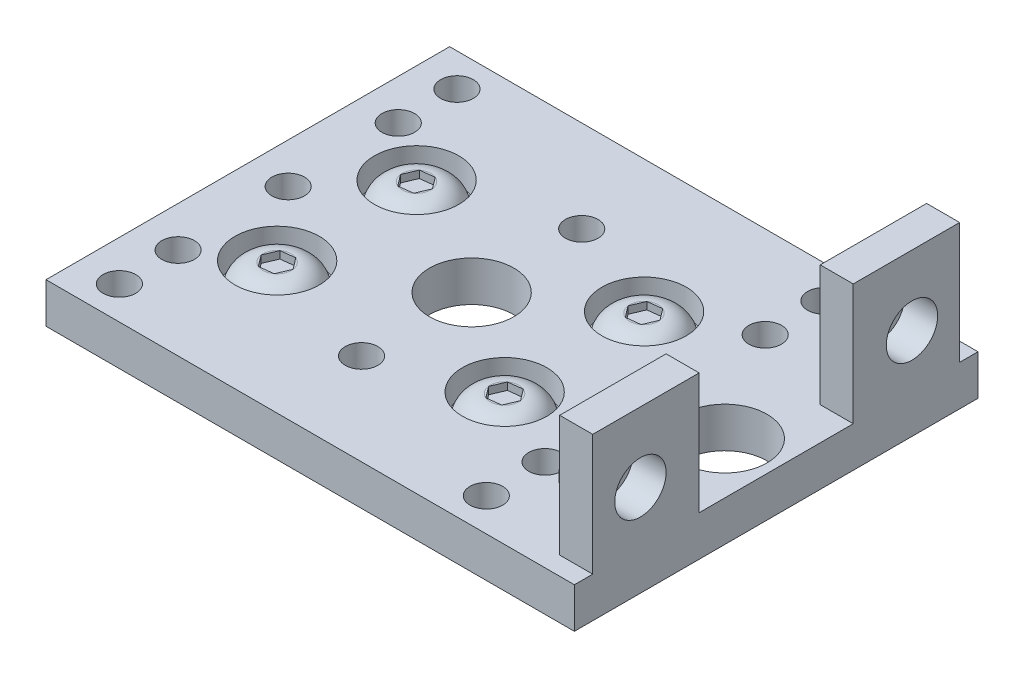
SolidWorks part; units mm, degrees
ref_plane "Front Plane" through (0, 0, 0) normal (0, 0, 1) x (1, 0, 0)
ref_plane "Top Plane" through (0, 0, 0) normal (0, 1, 0) x (1, 0, 0)
ref_plane "Right Plane" through (0, 0, 0) normal (1, 0, 0) x (0, 0, -1)
sketch "Sketch3" plane through (0, 0, 0) normal (0, 1, 0) x (1, 0, 0)
  line L1 (0, 27.94) -> (36.576, 27.94)
  line L2 (0, 27.94) -> (0, 0)
  line L3 (0, 0) -> (36.576, 0)
  line L4 (36.576, 27.94) -> (36.576, 0)
  dimension "D1" = 36.576
  dimension "D2" = 27.94
extrude "Base" add sketch "Sketch3" along normal blind 2.794
sketch "Sketch5" plane through (0, 0, 0) normal (0, 1, 0) x (1, 0, 0)
  line L0 (36.576, 26.67) -> (34.29, 26.67)
  line L1 (36.576, 26.67) -> (36.576, 19.304)
  line L2 (36.576, 19.304) -> (34.29, 19.304)
  line L3 (34.29, 26.67) -> (34.29, 19.304)
  line L4 (36.576, 8.636) -> (34.29, 8.636)
  line L5 (36.576, 8.636) -> (36.576, 1.27)
  line L6 (36.576, 1.27) -> (34.29, 1.27)
  line L7 (34.29, 8.636) -> (34.29, 1.27)
  line L8 (36.576, 0) -> (36.576, 27.94) construction
  line L9 (0, 0) -> (36.576, 0) construction
  line L10 (0, 27.94) -> (0, 0) construction
  dimension "D1" = 1.27
  dimension "D2" = 8.636
  dimension "D3" = 19.304
  dimension "D4" = 26.67
  dimension "D5" = 34.29
extrude "Tabs" add sketch "Sketch5" along normal blind 11.176
sketch "Sketch6" plane through (36.576, 0, 0) normal (1, 0, 0) x (0, 0, -1)
  circle A0 centre (4.572, 6.35) radius 1.778
  circle A1 centre (23.368, 6.35) radius 1.778
  dimension "D4" = 3.556
  dimension "D1" = 4.572
  dimension "D2" = 23.368
  dimension "D3" = 6.35
extrude "Tab Holes" cut sketch "Sketch6" against normal through all
sketch "Hole Locations" plane through (0, 2.794, 0) normal (0, 1, 0) x (1, 0, 0)
  line L0 (0, 27.94) -> (0, 0) construction
  line L1 (2.794, 25.654) -> (28.194, 25.654) construction
  line L2 (2.794, 25.654) -> (2.794, 2.286) construction
  line L3 (2.794, 2.286) -> (28.194, 2.286) construction
  line L4 (28.194, 25.654) -> (28.194, 2.286) construction
  line L5 (2.794, 21.59) -> (28.194, 21.59) construction
  line L6 (2.794, 13.97) -> (28.194, 13.97) construction
  line L7 (2.794, 6.35) -> (28.194, 6.35) construction
  line L8 (0, 0) -> (36.576, 0) construction
  line L9 (15.494, 21.59) -> (15.494, 6.35) construction
  dimension "D1" = 25.654
  dimension "D2" = 2.286
  dimension "D3" = 2.794
  dimension "D4" = 28.194
  dimension "D5" = 21.59
  dimension "D6" = 6.35
  dimension "D7" = 13.97
  dimension "D8" = 15.494
hole_wizard "#4-40 Tapped Hole1" positions "3DSketch1" profile "Sketch8" tap size "#4-40" standard "Ansi Inch"
sketch3d "3DSketch1"
  point P0 (2.794, 2.794, -25.654)
  point P3 (28.194, 2.794, -25.654)
  point P6 (28.194, 2.794, -21.59)
  point P9 (2.794, 2.794, -21.59)
  point P12 (15.494, 2.794, -21.59)
  point P15 (15.494, 2.794, -6.35)
  point P18 (2.794, 2.794, -13.97)
  point P21 (28.194, 2.794, -13.97)
  point P24 (28.194, 2.794, -6.35)
  point P27 (28.194, 2.794, -2.286)
  point P30 (2.794, 2.794, -6.35)
  point P33 (2.794, 2.794, -2.286)
sketch "Sketch8" plane through (2.794, 2.794, -25.654) normal (1, 0, 0) x (0, 0, 1)
  line L0 (0, 0) -> (0, 8.2992)
  line L1 (0, 8.2992) -> (1.1303, 7.62)
  line L2 (1.1303, 7.62) -> (1.1303, 0)
  line L5 (1.1303, 0) -> (0, 0)
  line L10 (0, 8.2992) -> (-1.1303, 7.62) construction
  line L11 (0, -6.35) -> (0, 107.95) construction
  dimension "Tap Drill Dia." = 2.2606
  dimension "Tap Drill Depth" = 7.62
  dimension "Drill Angle" = 118
sketch "Sketch9" plane through (0, 2.794, 0) normal (0, 1, 0) x (1, 0, 0)
  line L0 (0, 0) -> (36.576, 0) construction
  line L1 (6.858, 18.796) -> (22.606, 18.796) construction
  line L2 (6.858, 18.796) -> (6.858, 9.144) construction
  line L3 (6.858, 9.144) -> (22.606, 9.144) construction
  line L4 (22.606, 18.796) -> (22.606, 9.144) construction
  circle A0 centre (6.858, 18.796) radius 2.921
  circle A1 centre (22.606, 18.796) radius 2.921
  circle A2 centre (22.606, 9.144) radius 2.921
  circle A3 centre (6.858, 9.144) radius 2.921
  dimension "D3" = 5.842
  dimension "D1" = 9.144
  dimension "D2" = 18.796
  dimension "D4" = 6.858
  dimension "D5" = 15.748
extrude "Counter" cut sketch "Sketch9" against normal blind 1.778
sketch "Sketch10" plane through (0, 1.016, 0) normal (0, 1, 0) x (1, 0, 0)
  circle A0 centre (6.858, 18.796) radius 1.524
  circle A1 centre (22.606, 18.796) radius 1.524
  circle A2 centre (22.606, 9.144) radius 1.524
  circle A3 centre (6.858, 9.144) radius 1.524
  dimension "D1" = 3.048
extrude "Thru" cut sketch "Sketch10" against normal through all
sketch "Sketch11" plane through (0, 2.794, 0) normal (0, 1, 0) x (1, 0, 0)
  line L0 (2.794, 13.97) -> (15.494, 13.97) construction
  line L1 (15.494, 13.97) -> (33.02, 13.97) construction
  line L2 (15.494, 13.97) -> (15.494, 6.35) construction
  circle A0 centre (15.494, 13.97) radius 2.921
  circle A1 centre (33.02, 13.97) radius 2.921
  dimension "D2" = 5.842
  dimension "D1" = 33.02
extrude "Thru 2" cut sketch "Sketch11" against normal through all
sketch "Sketch12" plane through (0, 2.794, 0) normal (0, 1, 0) x (-1, 0, 0)
  line L1 (-3.937, -9.144) -> (-9.779, -9.144) construction
  circle A0 centre (-6.858, -9.144) radius 2.921 construction
sketch3d "3DSketch3"
  line L0 (3.937, 2.794, -9.144) -> (9.779, 2.794, -9.144) construction
sketch "Sketch13" plane through (0, 0, -9.144) normal (0, 0, 1) x (1, 0, 0)
  line L0 (4.1783, 1.016) -> (6.8516, 1.016)
  line L1 (5.8606, 2.6983) -> (6.8516, 2.6983)
  line L2 (9.779, 2.794) -> (9.779, 1.016) construction
  line L3 (9.779, 1.016) -> (9.525, 1.016) construction
  line L4 (6.8516, 1.016) -> (6.8516, 3.7159) construction
  line L5 (3.9243, 2.794) -> (3.9243, 1.016) construction
  line L6 (3.9243, 1.016) -> (4.1783, 1.016) construction
  line L7 (6.8516, 1.016) -> (6.8516, 2.6983)
  line L8 (9.779, 1.016) -> (3.937, 1.016) construction
  arc A0 (4.1783, 1.016) -> (5.8606, 2.6983) centre (5.8606, 1.016) cw
  dimension "D1" = 0.254
  dimension "D2" = 1.6823
revolve "Screw" add sketch "Sketch13" angle 360 about L4
sketch "Sketch14" plane through (0, 2.6983, 0) normal (0, 1, 0) x (1, 0, 0)
  line L1 (7.2385, 10.0565) -> (6.2549, 9.9353)
  line L2 (6.2549, 9.9353) -> (5.868, 9.0228)
  line L3 (5.868, 9.0228) -> (6.4648, 8.2315)
  line L4 (6.4648, 8.2315) -> (7.4484, 8.3527)
  line L5 (7.4484, 8.3527) -> (7.8353, 9.2652)
  line L6 (7.8353, 9.2652) -> (7.2385, 10.0565)
  circle A0 centre (6.8516, 9.144) radius 0.8583 construction
extrude "Screw Head" cut sketch "Sketch14" against normal blind 0.508
pattern_linear "LPattern1" count 2 spacing 9.652 along (0, 0, -1) count 2 spacing 15.748 along (1, 0, 0) of "Screw", "Screw Head"
sketch3d "3DSketch4" plane through (0, 0, 0) normal (0, 0, 1) x (1, 0, 0)
  dimension "D1" = 3.556
sketch "Sketch17" plane through (0, 6.35, 0) normal (0, 1, 0) x (-1, 0, 0)
  line L0 (-34.29, -1.8986) -> (-34.29, -4.572)
  line L1 (-32.6077, -3.5809) -> (-32.6077, -4.572)
  line L2 (-30.2003, -10.7716) -> (-31.9783, -10.7716) construction
  line L3 (-31.9783, -10.7716) -> (-31.9783, -10.5176) construction
  line L4 (-34.29, -4.572) -> (-31.5901, -4.572) construction
  line L5 (-32.512, -1.6447) -> (-34.29, -1.6447) construction
  line L6 (-34.29, -1.6447) -> (-34.29, -1.8986) construction
  line L7 (-34.29, -4.572) -> (-32.6077, -4.572)
  line L8 (-34.29, -6.35) -> (-34.29, -2.794) construction
  line L11 (0, 0) -> (-36.576, 0) construction
  line L12 (-34.29, -1.27) -> (-34.29, -8.636) construction
  arc A0 (-34.29, -1.8986) -> (-32.6077, -3.5809) centre (-34.29, -3.5809) cw
  dimension "D1" = 3.556
  dimension "D2" = 2.794
revolve "Vert Screw" add sketch "Sketch17" angle 360 about L4
sketch "Sketch18" plane through (32.6077, 0, 0) normal (-1, 0, 0) x (0, 0, 1)
  line L1 (-4.112, 7.2279) -> (-5.1023, 7.1873)
  line L2 (-5.1023, 7.1873) -> (-5.5623, 6.3094)
  line L3 (-5.5623, 6.3094) -> (-5.032, 5.4721)
  line L4 (-5.032, 5.4721) -> (-4.0417, 5.5127)
  line L5 (-4.0417, 5.5127) -> (-3.5817, 6.3906)
  line L6 (-3.5817, 6.3906) -> (-4.112, 7.2279)
  circle A0 centre (-4.572, 6.35) radius 0.8583 construction
  circle A1 centre (-4.572, 6.35) radius 0.9911 construction
extrude "V Screw Head" cut sketch "Sketch18" against normal blind 0.508
pattern_linear "LPattern2" count 2 spacing 18.796 along (0, 0, -1) of "Vert Screw", "V Screw Head"
